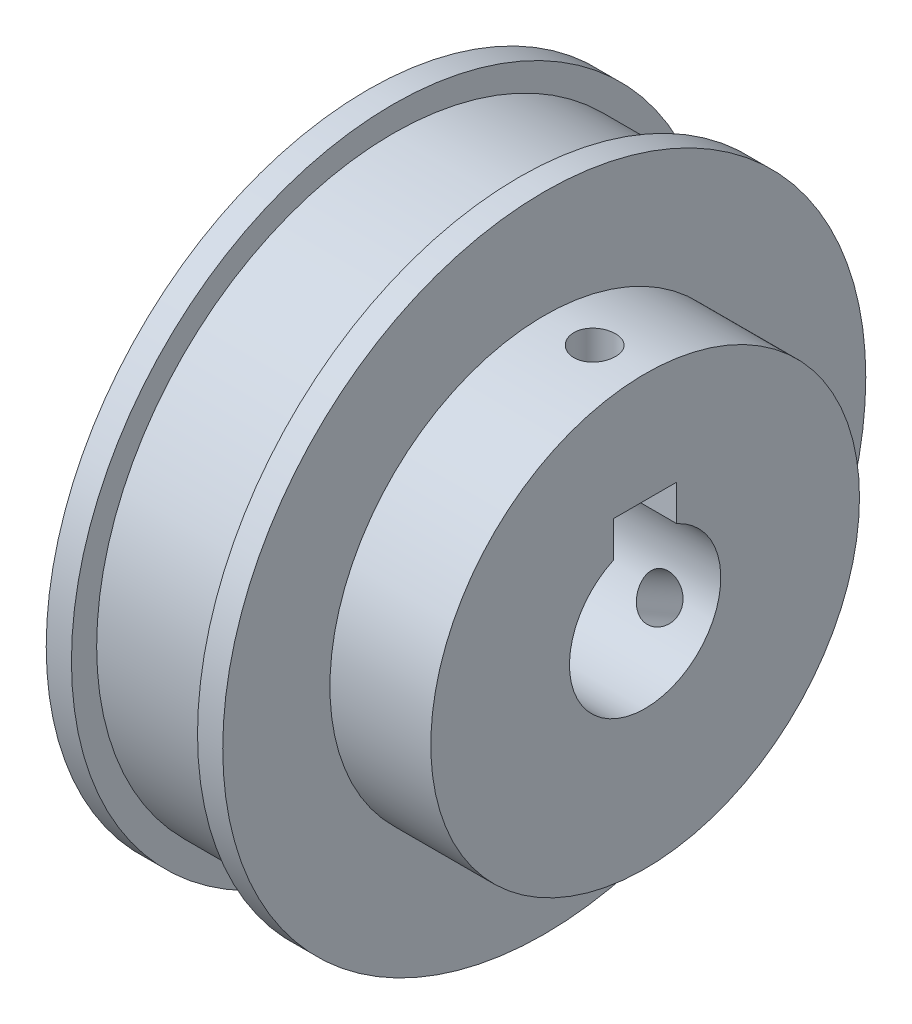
SolidWorks part; units mm, degrees
ref_plane "正面" through (0, 0, 0) normal (0, 0, 1) x (1, 0, 0)
ref_plane "平面" through (0, 0, 0) normal (0, 1, 0) x (1, 0, 0)
ref_plane "右側面" through (0, 0, 0) normal (1, 0, 0) x (0, 0, -1)
sketch "ｽｹｯﾁ1" plane through (0, 0, 0) normal (1, 0, 0) x (0, 0, -1)
  circle A0 centre (0, 0) radius 25.5
  dimension "D1" = 51
extrude "押し出し1" add sketch "ｽｹｯﾁ1" along normal blind 22
ref_plane "平面1" through (2, 0, 0) normal (1, 0, 0) x (0, 0, -1)
sketch "ｽｹｯﾁ2" plane through (2, 0, 0) normal (1, 0, 0) x (0, 0, -1)
  circle A0 centre (0, 0) radius 23.5
  dimension "D1" = 47
extrude "ｶｯﾄ - 押し出し1" cut sketch "ｽｹｯﾁ2" along normal blind 10 flip side to cut
sketch "ｽｹｯﾁ3" plane through (22, 0, 0) normal (1, 0, 0) x (0, 0, -1)
  circle A0 centre (0, 0) radius 17
  dimension "D1" = 34
extrude "ｶｯﾄ - 押し出し2" cut sketch "ｽｹｯﾁ3" against normal blind 8 flip side to cut
sketch "ｽｹｯﾁ4" plane through (22, 0, 0) normal (1, 0, 0) x (0, 0, -1)
  circle A0 centre (0, 0) radius 6
  dimension "D1" = 12
extrude "ｶｯﾄ - 押し出し3" cut sketch "ｽｹｯﾁ4" against normal through all
sketch "ｽｹｯﾁ5" plane through (22, 0, 0) normal (1, 0, 0) x (0, 0, -1)
  line L0 (-2.5, 5.4544) -> (2.5, 5.4544)
  line L1 (2.5, 5.4544) -> (2.5, 8.3)
  line L2 (2.5, 8.3) -> (-2.5, 8.3)
  line L3 (-2.5, 8.3) -> (-2.5, 5.4544)
  circle A0 centre (0, 0) radius 6 construction
  dimension "D1" = 5
  dimension "D2" = 14.3
extrude "ｶｯﾄ - 押し出し4" cut sketch "ｽｹｯﾁ5" against normal through all
sketch "ｽｹｯﾁ6" plane through (0, 0, 0) normal (0, 1, 0) x (1, 0, 0)
  line L0 (22, 0) -> (18, 0) construction
  line L1 (22, -17) -> (22, 17) construction
  line L2 (14, 0) -> (22, 0) construction
  circle A0 centre (18, 0) radius 1.65
  dimension "D1" = 3.3
  dimension "D2" = 4
extrude "ｶｯﾄ - 押し出し5" cut sketch "ｽｹｯﾁ6" along normal through all
pattern_circular "円形ﾊﾟﾀｰﾝ1" count 2 every 120 about axis through (14, 0, 0) along (1, 0, 0) of "ｶｯﾄ - 押し出し5"
